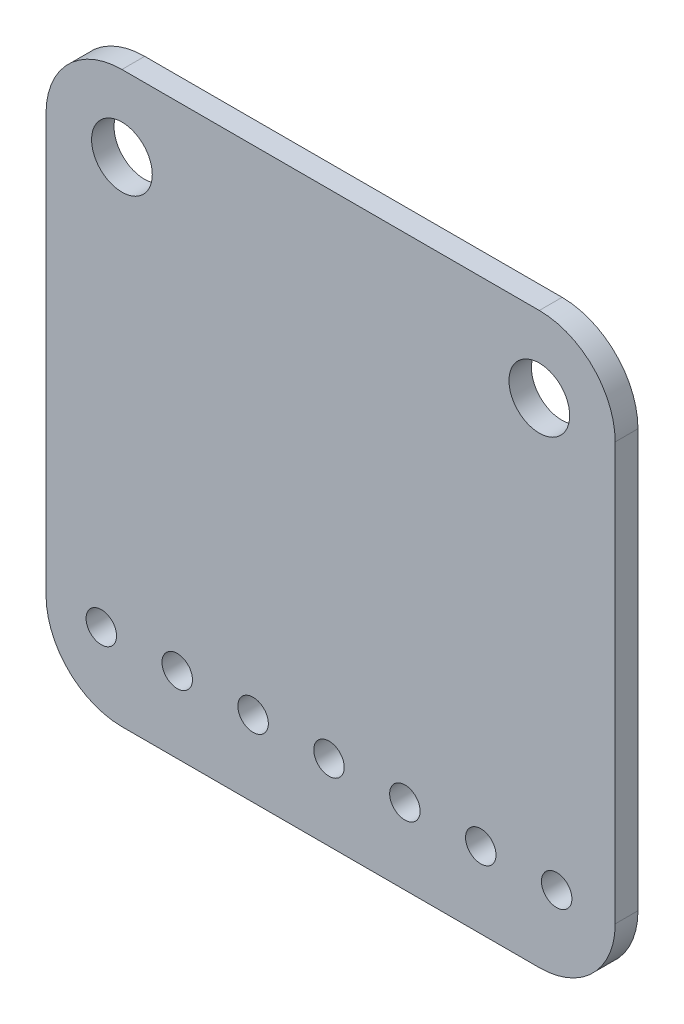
SolidWorks part; units mm, degrees
ref_plane "Ön Düzlem" through (0, 0, 0) normal (0, 0, 1) x (1, 0, 0)
ref_plane "Üst Düzlem" through (0, 0, 0) normal (0, 1, 0) x (1, 0, 0)
ref_plane "Sağ Düzlem" through (0, 0, 0) normal (1, 0, 0) x (0, 0, -1)
sketch "Çizim1" plane through (0, 0, 0) normal (0, 0, 1) x (1, 0, 0)
  line L0 (2.54, 0) -> (16.51, 0)
  line L1 (19.05, 2.54) -> (19.05, 16.51)
  line L2 (16.51, 19.05) -> (2.54, 19.05)
  line L3 (0, 16.51) -> (0, 2.54)
  arc A0 (0, 16.51) -> (2.54, 19.05) centre (2.54, 16.51) cw
  arc A1 (2.54, 0) -> (0, 2.54) centre (2.54, 2.54) cw
  arc A2 (19.05, 2.54) -> (16.51, 0) centre (16.51, 2.54) cw
  arc A3 (16.51, 19.05) -> (19.05, 16.51) centre (16.51, 16.51) cw
  point P7 (0, 19.05)
  point P10 (0, 0)
  point P15 (19.05, 19.05)
  dimension "D3" = 2.54
  dimension "D4" = 2.54
  dimension "D5" = 2.54
  dimension "D6" = 2.54
  dimension "D1" = 19.05
  dimension "D2" = 19.05
extrude "Yükseklik-Ekstrüzyon1" add sketch "Çizim1" along normal blind 0.762
sketch "Çizim2" plane through (0, 0, 0.762) normal (0, 0, 1) x (1, 0, 0)
  line L0 (2.54, 0) -> (16.51, 0) construction
  line L1 (19.05, 2.54) -> (19.05, 16.51) construction
  line L2 (0, 16.51) -> (0, 2.54) construction
  circle A0 centre (16.51, 16.51) radius 1.016
  circle A1 centre (2.54, 16.51) radius 1.016
  point P8 (1.8463, 16.51)
  point P11 (0.9208, 16.1295)
  dimension "D1" = 2.032
  dimension "D2" = 16.51
  dimension "D3" = 2.54
  dimension "D4" = 13.97
  dimension "D5" = 2.54
extrude "Kes-Ekstrüzyon1" cut sketch "Çizim2" against normal up to next
sketch "Çizim3" plane through (0, 0, 0.762) normal (0, 0, 1) x (1, 0, 0)
  line L1 (2.54, 0) -> (16.51, 0) construction
  circle A0 centre (1.8507, 2.54) radius 0.51
  circle A1 centre (4.3907, 2.54) radius 0.51
  circle A2 centre (6.9307, 2.54) radius 0.51
  circle A3 centre (9.4707, 2.54) radius 0.51
  circle A4 centre (12.0107, 2.54) radius 0.51
  circle A5 centre (14.5507, 2.54) radius 0.51
  circle A6 centre (17.0907, 2.54) radius 0.51
  point P2 (4.3712, 2.1273)
  point P5 (4.3907, 2.54)
  dimension "D1" = 1.02
  dimension "D3" = 2.54
  dimension "D2" = 7
extrude "Kes-Ekstrüzyon2" cut sketch "Çizim3" against normal up to next
sketch "Çizim4" plane through (0, 0, 0) normal (0, 0, -1) x (-1, 0, 0)
  circle A0 centre (-16.51, 16.51) radius 1.5
extrude "Kes-Ekstrüzyon3" cut sketch "Çizim4" against normal blind 0.01
sketch "Çizim5" plane through (0, 0, 0) normal (0, 0, -1) x (-1, 0, 0)
  circle A1 centre (-2.54, 16.51) radius 1.5
  dimension "D1" = 3
extrude "Kes-Ekstrüzyon4" cut sketch "Çizim5" against normal blind 0.01
sketch "Çizim6" plane through (0, 0, 0) normal (0, 0, -1) x (-1, 0, 0)
  circle A0 centre (-17.0907, 2.54) radius 0.75
extrude "Kes-Ekstrüzyon5" cut sketch "Çizim6" against normal blind 0.01
sketch "Çizim7" plane through (0, 0, 0) normal (0, 0, -1) x (-1, 0, 0)
  circle A0 centre (-14.5507, 2.54) radius 0.75
  circle A1 centre (-12.0107, 2.54) radius 0.75
  circle A2 centre (-9.4707, 2.54) radius 0.75
  circle A3 centre (-6.9307, 2.54) radius 0.75
  circle A4 centre (-4.3907, 2.54) radius 0.75
  circle A5 centre (-1.8507, 2.54) radius 0.75
  dimension "D1" = 6
extrude "Kes-Ekstrüzyon6" cut sketch "Çizim7" against normal blind 0.01
sketch "Çizim8" plane through (0, 0, 0) normal (0, 0, -1) x (-1, 0, 0)
  line L0 (-13.3396, 16.2124) -> (-4.4043, 16.2124) construction
  text T0 "ADXL335" font "Century Gothic" height in points 5
  point P3 (-13.5912, 16.2231)
  point P4 (-13.3396, 16.2124)
extrude "Yükseklik-Ekstrüzyon2" add sketch "Çizim8" along normal blind 0.1
sketch "Çizim9" plane through (0, 0, 0) normal (0, 0, -1) x (-1, 0, 0)
  line L0 (-18.0063, 3.7727) -> (-0.964, 3.7727) construction
  text T0 "Vin        3Vo     GND    Zout    Yout      Xout     Test" font "Century Gothic" height in points 2
extrude "Yükseklik-Ekstrüzyon4" add sketch "Çizim9" along normal blind 0.1
sketch "Çizim11" plane through (0, 0, 0) normal (0, 0, -1) x (-1, 0, 0)
  line L0 (-12.171, 14.1515) -> (-7.1366, 14.1515)
  line L1 (-7.1366, 14.1515) -> (-7.1366, 9.0137)
  line L2 (-7.1366, 9.0137) -> (-12.171, 9.0137)
  line L3 (-12.171, 9.0137) -> (-12.171, 14.1515)
extrude "Yükseklik-Ekstrüzyon5" add sketch "Çizim11" along normal blind 0.6
sketch "Çizim12" plane through (0, 0, 0) normal (0, 0, -1) x (-1, 0, 0)
  line L1 (-17.2587, 10.0301) -> (-14.541, 10.0301)
  line L2 (-17.2587, 10.0301) -> (-17.2587, 8.7088)
  line L3 (-17.2587, 8.7088) -> (-14.541, 8.7088)
  line L4 (-14.541, 10.0301) -> (-14.541, 8.7088)
extrude "Yükseklik-Ekstrüzyon6" add sketch "Çizim12" along normal blind 0.4
sketch "Çizim13" plane through (0, 0, 0) normal (0, 0, -1) x (-1, 0, 0)
  line L1 (-13.2443, 8.1902) -> (-10.5566, 8.1902)
  line L2 (-13.2443, 8.1902) -> (-13.2443, 6.8989)
  line L3 (-13.2443, 6.8989) -> (-10.5566, 6.8989)
  line L4 (-10.5566, 8.1902) -> (-10.5566, 6.8989)
  line L5 (-8.7998, 8.1902) -> (-6.0971, 8.1902)
  line L6 (-8.7998, 8.1902) -> (-8.7998, 6.8989)
  line L7 (-8.7998, 6.8989) -> (-6.0971, 6.8989)
  line L8 (-6.0971, 8.1902) -> (-6.0971, 6.8989)
  line L9 (-4.7908, 8.1902) -> (-2.2532, 8.1902)
  line L10 (-4.7908, 8.1902) -> (-4.7908, 6.8989)
  line L11 (-4.7908, 6.8989) -> (-2.2532, 6.8989)
  line L12 (-2.2532, 8.1902) -> (-2.2532, 6.8989)
extrude "Yükseklik-Ekstrüzyon7" add sketch "Çizim13" along normal blind 0.4
sketch "Çizim14" plane through (0, 0, 0) normal (0, 0, -1) x (-1, 0, 0)
  line L1 (-5.1052, 10.5252) -> (-2.3555, 10.5252)
  line L2 (-5.1052, 10.5252) -> (-5.1052, 9.2588)
  line L3 (-5.1052, 9.2588) -> (-2.3555, 9.2588)
  line L4 (-2.3555, 10.5252) -> (-2.3555, 9.2588)
extrude "Yükseklik-Ekstrüzyon8" add sketch "Çizim14" along normal blind 0.4
sketch "Çizim15" plane through (0, 0, 0) normal (0, 0, -1) x (-1, 0, 0)
  line L1 (-16.402, 10.8737) -> (-14.39, 10.8737)
  line L2 (-16.402, 10.8737) -> (-16.402, 13.8467)
  line L3 (-16.402, 13.8467) -> (-14.39, 13.8467)
  line L4 (-14.39, 10.8737) -> (-14.39, 13.8467)
extrude "Yükseklik-Ekstrüzyon9" add sketch "Çizim15" along normal blind 0.5
